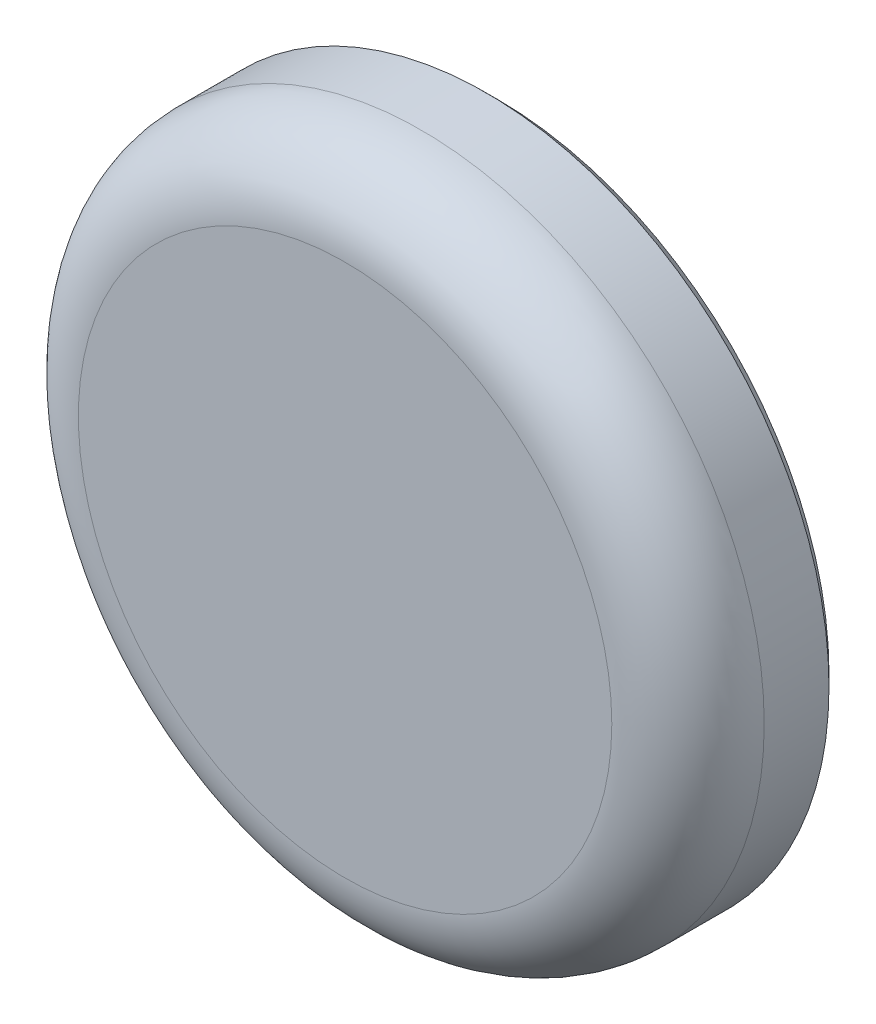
SolidWorks part; units mm, degrees
ref_plane "Спереди" through (0, 0, 0) normal (0, 0, 1) x (1, 0, 0)
ref_plane "Сверху" through (0, 0, 0) normal (0, 1, 0) x (1, 0, 0)
ref_plane "Справа" through (0, 0, 0) normal (1, 0, 0) x (0, 0, -1)
sketch "Эскиз1" plane through (0, 0, 0) normal (0, 0, 1) x (1, 0, 0)
  circle A0 centre (0, 0) radius 4.5
  dimension "D1" = 9
extrude "Бобышка-Вытянуть1" add sketch "Эскиз1" along normal blind 2
fillet "Скругление1" radius 1 1 edges at (4.5, 0, 2)
chamfer "Фаска1" distance 0.15 angle 45 1 edges at (4.5, 0, 0)
